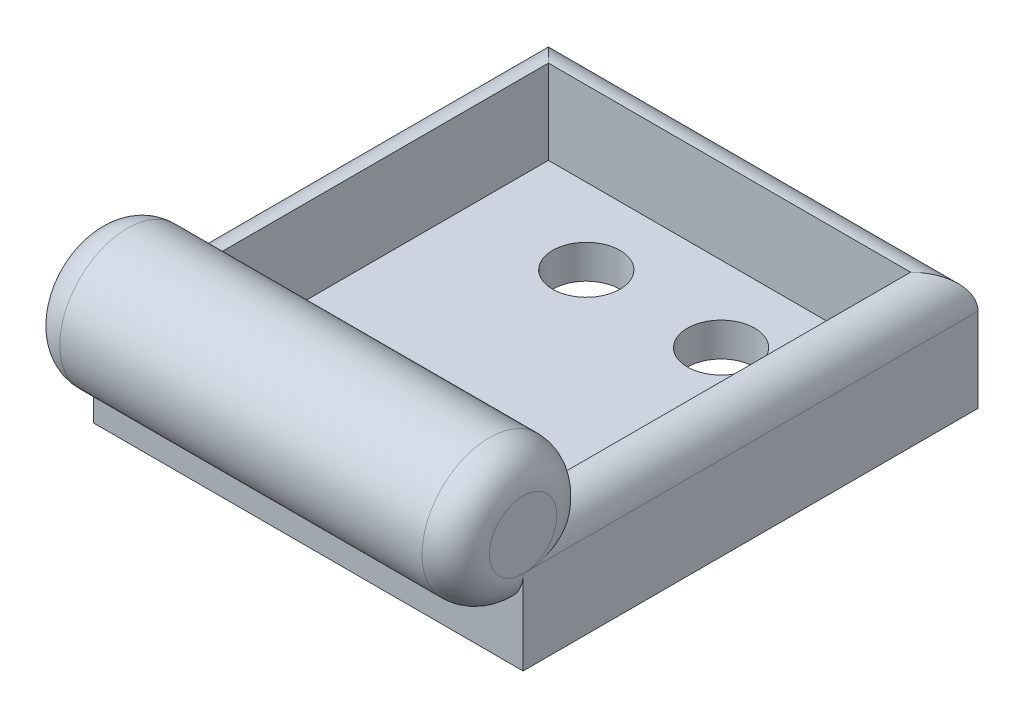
SolidWorks part; units mm, degrees
ref_plane "Front Plane" through (0, 0, 0) normal (0, 0, 1) x (1, 0, 0)
ref_plane "Top Plane" through (0, 0, 0) normal (0, 1, 0) x (1, 0, 0)
ref_plane "Right Plane" through (0, 0, 0) normal (1, 0, 0) x (0, 0, -1)
sketch "Sketch1" plane through (0, 0, 0) normal (0, 1, 0) x (1, 0, 0)
  line L1 (-12.75, 13.5) -> (12.75, 13.5)
  line L2 (-12.75, 13.5) -> (-12.75, -13.5)
  line L3 (-12.75, -13.5) -> (12.75, -13.5)
  line L4 (12.75, 13.5) -> (12.75, -13.5)
  line L5 (-12.75, 13.5) -> (12.75, -13.5) construction
  line L6 (-12.75, -13.5) -> (12.75, 13.5) construction
  point P0 (0, 0)
  dimension "D1" = 25.5
  dimension "D2" = 27
extrude "Boss-Extrude1" add sketch "Sketch1" along normal blind 7
shell "Shell1" thickness 2
sketch "Sketch3" plane through (0, 0, 0) normal (0, -1, 0) x (1, 0, 0)
  line L0 (0, 13.5) -> (0, -13.5) construction
  line L1 (-12.75, 13.5) -> (12.75, 13.5) construction
  line L2 (12.75, -13.5) -> (-12.75, -13.5) construction
  line L3 (-12.75, -13.5) -> (-12.75, 13.5) construction
  line L4 (-12.75, 0) -> (12.75, 0) construction
  line L5 (12.75, 13.5) -> (12.75, -13.5) construction
  line L6 (-12.75, 8.5) -> (12.75, 8.5) construction
  line L8 (-9.5, 10.5) -> (9.5, 10.5)
  line L9 (-10.5, 9.5) -> (-10.5, 7.5)
  line L10 (-9.5, 6.5) -> (9.5, 6.5)
  line L11 (10.5, 9.5) -> (10.5, 7.5)
  line L12 (-10.5, 10.5) -> (10.5, 6.5) construction
  line L13 (-10.5, 6.5) -> (10.5, 10.5) construction
  arc A0 (9.5, 6.5) -> (10.5, 7.5) centre (9.5, 7.5) ccw
  arc A1 (9.5, 10.5) -> (10.5, 9.5) centre (9.5, 9.5) cw
  arc A2 (-10.5, 7.5) -> (-9.5, 6.5) centre (-9.5, 7.5) ccw
  arc A3 (-9.5, 10.5) -> (-10.5, 9.5) centre (-9.5, 9.5) ccw
  point P14 (0, 8.5)
  dimension "D4" = 1
  dimension "D1" = 5
  dimension "D2" = 21
  dimension "D3" = 4
extrude "Cut-Extrude2" cut sketch "Sketch3" against normal blind 7
sketch "Sketch4" plane through (12.75, 0, 0) normal (1, 0, 0) x (0, 0, -1)
  line L1 (-13.5, 3) -> (13.5, 3) construction
  line L2 (13.5, 7) -> (13.5, 0) construction
  circle A0 centre (-13.5, 7) radius 4
  dimension "D1" = 8
extrude "Boss-Extrude2" add sketch "Sketch4" against normal through all
fillet "Fillet2" radius 2 5 edges at (12.75, 9.8284, 16.3284) (-12.75, 9.8284, 16.3284) (0, 7, -13.5) (-12.75, 7, -2) (12.75, 7, -2)
ref_plane "Plane1" through (4.75, 0, 0) normal (1, 0, 0) x (0, 0, -1)
sketch "Sketch5" plane through (0, 2, 0) normal (0, 1, 0) x (1, 0, 0)
  line L0 (0, 11.5) -> (0, -9.5) construction
  line L1 (10.75, 11.5) -> (-10.75, 11.5) construction
  line L2 (10.75, -9.5) -> (-10.75, -9.5) construction
  line L3 (-10.75, 0) -> (10.75, 0) construction
  line L4 (-10.75, 11.5) -> (-10.75, -11.5) construction
  line L5 (10.75, -11.5) -> (10.75, 11.5) construction
  line L6 (-10.75, 7) -> (10.75, 7) construction
  line L13 (-10.75, 11.5) -> (-10.75, -9.5) construction
  line L14 (10.75, -9.5) -> (10.75, 11.5) construction
  line L15 (-4, 9.5) -> (-4, -9.5) construction
  circle A0 centre (-4, 7) radius 2
  circle A1 centre (4, 7) radius 2
  point P12 (0, 0)
  dimension "D5" = 4
extrude "Cut-Extrude4" cut sketch "Sketch5" against normal through all
